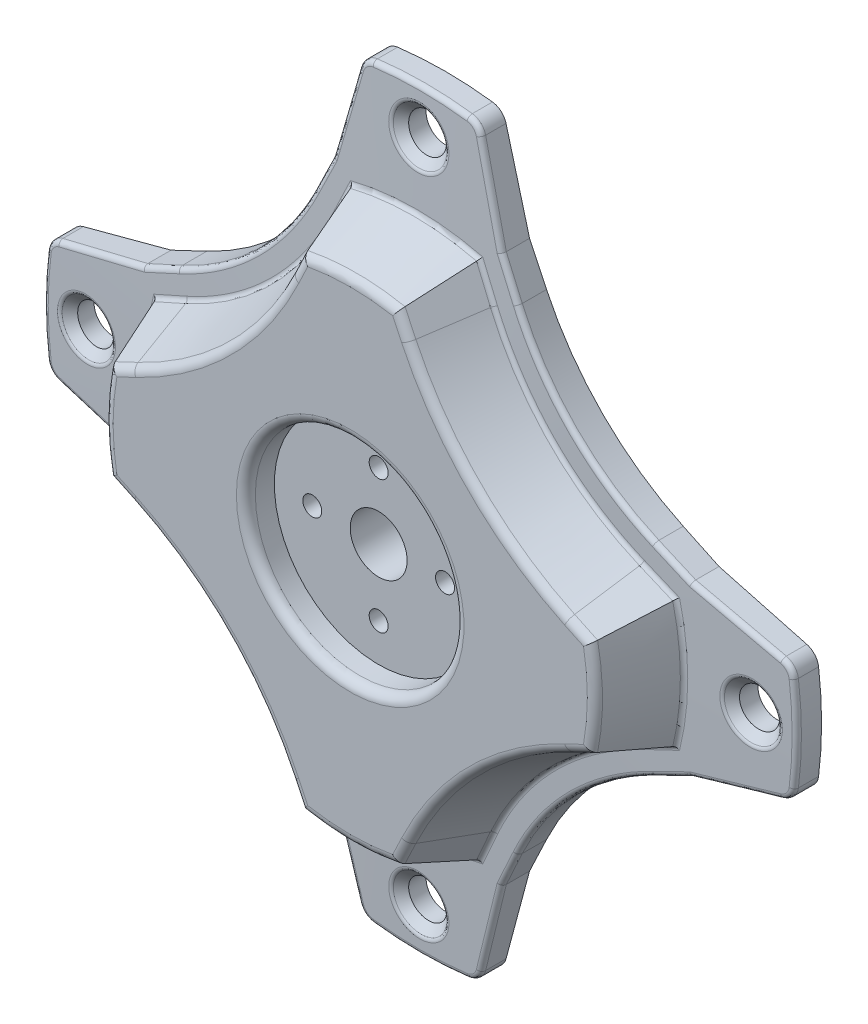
SolidWorks part; units mm, degrees
ref_plane "Front Plane" through (0, 0, 0) normal (0, 0, 1) x (1, 0, 0)
ref_plane "Top Plane" through (0, 0, 0) normal (0, 1, 0) x (1, 0, 0)
ref_plane "Right Plane" through (0, 0, 0) normal (1, 0, 0) x (0, 0, -1)
sketch "Sketch1" plane through (0, 0, 0) normal (0, 0, 1) x (1, 0, 0)
  line L24 (58.7956, 87.0406) -> (49.5461, 89.519)
  line L25 (49.5461, 89.519) -> (45.7694, 91.308)
  line L26 (29.5682, 109.4969) -> (27.0898, 118.7464)
  line L27 (14.2274, 118.7464) -> (11.749, 109.4969)
  line L28 (49.5461, 89.519) -> (45.7694, 91.308)
  line L29 (-8.2289, 89.519) -> (-17.4784, 87.0406)
  line L30 (-17.4784, 74.1781) -> (-8.2289, 71.6998)
  line L31 (31.3572, 105.7202) -> (29.5682, 109.4969)
  line L32 (11.749, 51.7219) -> (14.2274, 42.4724)
  line L33 (27.0898, 42.4724) -> (29.5682, 51.7219)
  line L34 (31.3572, 105.7202) -> (29.5682, 109.4969)
  line L35 (49.5461, 71.6998) -> (58.7956, 74.1781)
  line L36 (58.7956, 87.0406) -> (49.5461, 89.519)
  line L38 (29.5682, 109.4969) -> (27.0898, 118.7464)
  line L39 (14.2274, 118.7464) -> (11.749, 109.4969)
  line L41 (-8.2289, 89.519) -> (-17.4784, 87.0406)
  line L42 (-17.4784, 74.1781) -> (-8.2289, 71.6998)
  line L44 (11.749, 51.7219) -> (14.2274, 42.4724)
  line L45 (27.0898, 42.4724) -> (29.5682, 51.7219)
  line L47 (49.5461, 71.6998) -> (58.7956, 74.1781)
  line L76 (11.749, 109.4969) -> (9.96, 105.7202)
  line L77 (11.749, 109.4969) -> (9.96, 105.7202)
  line L78 (-4.4522, 91.308) -> (-8.2289, 89.519)
  line L79 (-4.4522, 91.308) -> (-8.2289, 89.519)
  line L80 (-8.2289, 71.6998) -> (-4.4522, 69.9108)
  line L81 (-8.2289, 71.6998) -> (-4.4522, 69.9108)
  line L82 (9.96, 55.4986) -> (11.749, 51.7219)
  line L83 (9.96, 55.4986) -> (11.749, 51.7219)
  line L84 (29.5682, 51.7219) -> (31.3572, 55.4986)
  line L85 (29.5682, 51.7219) -> (31.3572, 55.4986)
  line L86 (45.7694, 69.9108) -> (49.5461, 71.6998)
  line L87 (45.7694, 69.9108) -> (49.5461, 71.6998)
  arc A40 (60.042, 75.606) -> (60.042, 85.6128) centre (20.6586, 80.6094) ccw
  arc A41 (60.042, 85.6128) -> (58.7956, 87.0406) centre (58.3556, 85.3986) ccw
  arc A42 (31.3572, 105.7202) -> (45.7694, 91.308) centre (58.7404, 118.6912) ccw
  arc A43 (31.3572, 105.7202) -> (45.7694, 91.308) centre (58.7404, 118.6912) ccw
  arc A44 (27.0898, 118.7464) -> (25.662, 119.9928) centre (25.4478, 118.3064) ccw
  arc A45 (25.662, 119.9928) -> (15.6552, 119.9928) centre (20.6586, 80.6094) ccw
  arc A46 (15.6552, 119.9928) -> (14.2274, 118.7464) centre (15.8694, 118.3064) ccw
  arc A47 (-4.4522, 91.308) -> (9.96, 105.7202) centre (-17.4232, 118.6912) ccw
  arc A48 (-4.4522, 91.308) -> (9.96, 105.7202) centre (-17.4232, 118.6912) ccw
  arc A49 (-17.4784, 87.0406) -> (-18.7248, 85.6128) centre (-17.0384, 85.3986) ccw
  arc A50 (-18.7248, 85.6128) -> (-18.7248, 75.606) centre (20.6586, 80.6094) ccw
  arc A51 (-18.7248, 75.606) -> (-17.4784, 74.1781) centre (-17.0384, 75.8202) ccw
  arc A52 (9.96, 55.4986) -> (-4.4522, 69.9108) centre (-17.4232, 42.5275) ccw
  arc A53 (9.96, 55.4986) -> (-4.4522, 69.9108) centre (-17.4232, 42.5275) ccw
  arc A54 (14.2274, 42.4724) -> (15.6552, 41.2259) centre (15.8694, 42.9124) ccw
  arc A55 (15.6552, 41.2259) -> (25.662, 41.2259) centre (20.6586, 80.6094) ccw
  arc A56 (25.662, 41.2259) -> (27.0898, 42.4724) centre (25.4478, 42.9124) ccw
  arc A57 (45.7694, 69.9108) -> (31.3572, 55.4986) centre (58.7404, 42.5275) ccw
  arc A58 (45.7694, 69.9108) -> (31.3572, 55.4986) centre (58.7404, 42.5275) ccw
  arc A59 (58.7956, 74.1781) -> (60.042, 75.606) centre (58.3556, 75.8202) ccw
  arc A60 (60.042, 75.606) -> (60.042, 85.6128) centre (20.6586, 80.6094) ccw
  arc A61 (60.042, 85.6128) -> (58.7956, 87.0406) centre (58.3556, 85.3986) ccw
  arc A64 (27.0898, 118.7464) -> (25.662, 119.9928) centre (25.4478, 118.3064) ccw
  arc A65 (25.662, 119.9928) -> (15.6552, 119.9928) centre (20.6586, 80.6094) ccw
  arc A66 (15.6552, 119.9928) -> (14.2274, 118.7464) centre (15.8694, 118.3064) ccw
  arc A69 (-17.4784, 87.0406) -> (-18.7248, 85.6128) centre (-17.0384, 85.3986) ccw
  arc A70 (-18.7248, 85.6128) -> (-18.7248, 75.606) centre (20.6586, 80.6094) ccw
  arc A71 (-18.7248, 75.606) -> (-17.4784, 74.1781) centre (-17.0384, 75.8202) ccw
  arc A74 (14.2274, 42.4724) -> (15.6552, 41.2259) centre (15.8694, 42.9124) ccw
  arc A75 (15.6552, 41.2259) -> (25.662, 41.2259) centre (20.6586, 80.6094) ccw
  arc A76 (25.662, 41.2259) -> (27.0898, 42.4724) centre (25.4478, 42.9124) ccw
  arc A79 (58.7956, 74.1781) -> (60.042, 75.606) centre (58.3556, 75.8202) ccw
  dimension "D1" = 0.3
extrude "Boss-Extrude1" add sketch "Sketch1" along normal blind 4
sketch "Sketch2" plane through (20.6586, 80.6094, -44.1) normal (0, -1, 0) x (1, 0, 0)
  line L0 (0, 48.1) -> (0, 76.0511) construction
  line L1 (5.0034, 48.1) -> (-5.0034, 48.1) construction
  line L2 (59.9345, 46) -> (0, 48.093)
  line L4 (59.9345, 48.5424) -> (59.9345, 46)
  line L5 (0, 48.093) -> (0, 48.5424)
  line L6 (0, 48.5424) -> (59.9345, 48.5424)
  dimension "D1" = 2
revolve "Cut-Revolve1" cut sketch "Sketch2" angle 360 about L0
sketch "Sketch3" plane through (0, 0, 0) normal (0, 0, -1) x (-1, 0, 0)
  line L48 (-28.1545, 108.9775) -> (-30.0016, 105.0781)
  line L49 (-25.641, 118.3582) -> (-28.1545, 108.9775)
  line L50 (-13.1627, 108.9775) -> (-15.6762, 118.3582)
  line L51 (-11.3156, 105.0781) -> (-13.1627, 108.9775)
  line L52 (7.7095, 88.1053) -> (3.8101, 89.9524)
  line L53 (17.0902, 85.5918) -> (7.7095, 88.1053)
  line L54 (7.7095, 73.1135) -> (17.0902, 75.627)
  line L55 (3.8101, 71.2664) -> (7.7095, 73.1135)
  line L56 (-13.1627, 52.2413) -> (-11.3156, 56.1407)
  line L57 (-15.6762, 42.8606) -> (-13.1627, 52.2413)
  line L58 (-28.1545, 52.2413) -> (-25.641, 42.8606)
  line L59 (-30.0016, 56.1407) -> (-28.1545, 52.2413)
  line L60 (-49.0267, 73.1135) -> (-45.1273, 71.2664)
  line L61 (-58.4074, 75.627) -> (-49.0267, 73.1135)
  line L62 (-49.0267, 88.1053) -> (-58.4074, 85.5918)
  line L63 (-45.1273, 89.9524) -> (-49.0267, 88.1053)
  line L64 (-28.1545, 108.9775) -> (-30.0016, 105.0781)
  line L65 (-25.641, 118.3582) -> (-28.1545, 108.9775)
  line L66 (-13.1627, 108.9775) -> (-15.6762, 118.3582)
  line L67 (-11.3156, 105.0781) -> (-13.1627, 108.9775)
  line L68 (7.7095, 88.1053) -> (3.8101, 89.9524)
  line L69 (17.0902, 85.5918) -> (7.7095, 88.1053)
  line L70 (7.7095, 73.1135) -> (17.0902, 75.627)
  line L71 (3.8101, 71.2664) -> (7.7095, 73.1135)
  line L72 (-13.1627, 52.2413) -> (-11.3156, 56.1407)
  line L73 (-15.6762, 42.8606) -> (-13.1627, 52.2413)
  line L74 (-28.1545, 52.2413) -> (-25.641, 42.8606)
  line L75 (-30.0016, 56.1407) -> (-28.1545, 52.2413)
  line L76 (-49.0267, 73.1135) -> (-45.1273, 71.2664)
  line L77 (-58.4074, 75.627) -> (-49.0267, 73.1135)
  line L78 (-49.0267, 88.1053) -> (-58.4074, 85.5918)
  line L79 (-45.1273, 89.9524) -> (-49.0267, 88.1053)
  arc A32 (-28.1545, 52.2413) -> (-13.1627, 52.2413) centre (-20.6586, 80.6094) ccw
  arc A33 (7.7095, 73.1135) -> (7.7095, 88.1053) centre (-20.6586, 80.6094) ccw
  arc A34 (-13.1627, 108.9775) -> (-28.1545, 108.9775) centre (-20.6586, 80.6094) ccw
  arc A35 (-49.0267, 88.1053) -> (-49.0267, 73.1135) centre (-20.6586, 80.6094) ccw
  arc A48 (-45.1273, 89.9524) -> (-30.0016, 105.0781) centre (-58.7404, 118.6912) ccw
  arc A49 (-25.473, 118.5048) -> (-25.641, 118.3582) centre (-25.4478, 118.3064) ccw
  arc A50 (-15.8442, 118.5048) -> (-25.473, 118.5048) centre (-20.6586, 80.6094) ccw
  arc A51 (-15.6762, 118.3582) -> (-15.8442, 118.5048) centre (-15.8694, 118.3064) ccw
  arc A52 (-11.3156, 105.0781) -> (3.8101, 89.9524) centre (17.4232, 118.6912) ccw
  arc A53 (17.2368, 85.4238) -> (17.0902, 85.5918) centre (17.0384, 85.3986) ccw
  arc A54 (17.2368, 75.795) -> (17.2368, 85.4238) centre (-20.6586, 80.6094) ccw
  arc A55 (17.0902, 75.627) -> (17.2368, 75.795) centre (17.0384, 75.8202) ccw
  arc A56 (3.8101, 71.2664) -> (-11.3156, 56.1407) centre (17.4232, 42.5275) ccw
  arc A57 (-15.8442, 42.714) -> (-15.6762, 42.8606) centre (-15.8694, 42.9124) ccw
  arc A58 (-25.473, 42.714) -> (-15.8442, 42.714) centre (-20.6586, 80.6094) ccw
  arc A59 (-25.641, 42.8606) -> (-25.473, 42.714) centre (-25.4478, 42.9124) ccw
  arc A60 (-30.0016, 56.1407) -> (-45.1273, 71.2664) centre (-58.7404, 42.5275) ccw
  arc A61 (-58.554, 75.795) -> (-58.4074, 75.627) centre (-58.3556, 75.8202) ccw
  arc A62 (-58.554, 85.4238) -> (-58.554, 75.795) centre (-20.6586, 80.6094) ccw
  arc A63 (-58.4074, 85.5918) -> (-58.554, 85.4238) centre (-58.3556, 85.3986) ccw
  arc A64 (-45.1273, 89.9524) -> (-30.0016, 105.0781) centre (-58.7404, 118.6912) ccw
  arc A65 (-25.473, 118.5048) -> (-25.641, 118.3582) centre (-25.4478, 118.3064) ccw
  arc A66 (-15.8442, 118.5048) -> (-25.473, 118.5048) centre (-20.6586, 80.6094) ccw
  arc A67 (-15.6762, 118.3582) -> (-15.8442, 118.5048) centre (-15.8694, 118.3064) ccw
  arc A68 (-11.3156, 105.0781) -> (3.8101, 89.9524) centre (17.4232, 118.6912) ccw
  arc A69 (17.2368, 85.4238) -> (17.0902, 85.5918) centre (17.0384, 85.3986) ccw
  arc A70 (17.2368, 75.795) -> (17.2368, 85.4238) centre (-20.6586, 80.6094) ccw
  arc A71 (17.0902, 75.627) -> (17.2368, 75.795) centre (17.0384, 75.8202) ccw
  arc A72 (3.8101, 71.2664) -> (-11.3156, 56.1407) centre (17.4232, 42.5275) ccw
  arc A73 (-15.8442, 42.714) -> (-15.6762, 42.8606) centre (-15.8694, 42.9124) ccw
  arc A74 (-25.473, 42.714) -> (-15.8442, 42.714) centre (-20.6586, 80.6094) ccw
  arc A75 (-25.641, 42.8606) -> (-25.473, 42.714) centre (-25.4478, 42.9124) ccw
  arc A76 (-30.0016, 56.1407) -> (-45.1273, 71.2664) centre (-58.7404, 42.5275) ccw
  arc A77 (-58.554, 75.795) -> (-58.4074, 75.627) centre (-58.3556, 75.8202) ccw
  arc A78 (-58.554, 85.4238) -> (-58.554, 75.795) centre (-20.6586, 80.6094) ccw
  arc A79 (-58.4074, 85.5918) -> (-58.554, 85.4238) centre (-58.3556, 85.3986) ccw
  dimension "D1" = 1.5
extrude "Boss-Extrude2" add sketch "Sketch3" against normal blind 10 draft 20 contours A76 L75 A32 L72 A72 L71 A33 L68 A68 L67 A34 L64 A64 L79 A35 L76
sketch "Sketch5" plane through (0, 0, 10) normal (0, 0, 1) x (1, 0, 0)
  circle A0 centre (20.6586, 80.6094) radius 12.5
  dimension "D1" = 25
sketch "Sketch6" plane through (0, 0, 0) normal (0, 0, -1) x (-1, 0, 0)
  circle A0 centre (-20.6586, 45.6094) radius 2
  circle A1 centre (14.3414, 80.6094) radius 2
  circle A2 centre (-20.6586, 115.6094) radius 2
  circle A3 centre (-55.6586, 80.6094) radius 2.0146
extrude "Cut-Extrude1" cut sketch "Sketch6" against normal through all
chamfer "Chamfer1" distance 1 angle 45 4 edges at (21.7038, 47.3145, 2.8297) (-13.2846, 82.3074, 2.8062) (21.7187, 117.3054, 2.711) (56.7081, 82.3291, 2.7327)
sketch "Sketch7" plane through (0, 0, 10) normal (0, 0, 1) x (1, 0, 0)
  circle A0 centre (20.6586, 80.6094) radius 11
  dimension "D1" = 22
extrude "Cut-Extrude2" cut sketch "Sketch7" against normal blind 3
fillet "Fillet1" radius 1 17 edges at (26.1656, 56.5447, 10) (20.6586, 54.9074, 10) (15.1516, 56.5447, 10) (7.6364, 67.5872, 10) (-3.4061, 75.1024, 10) (-5.0434, 80.6094, 10) (-3.4061, 86.1163, 10) (7.6364, 93.6316, 10) (15.1516, 104.6741, 10) (20.6586, 106.3114, 10) (26.1656, 104.6741, 10) (33.6808, 93.6316, 10) (44.7233, 86.1163, 10) (46.3606, 80.6094, 10) (44.7233, 75.1024, 10) (33.6808, 67.5872, 10) (31.6586, 80.6094, 10)
fillet "Fillet2" radius 0.5 52 edges at (48.906, 80.6094, 3.0065) (34.7341, 96.0665, 3.2629) (20.6586, 108.8568, 3.0065) (5.2015, 94.6849, 3.2629) (6.5831, 65.1523, 3.2629) (20.6586, 52.362, 3.0065) (36.1157, 66.5339, 3.2629) (59.5392, 86.6188, 2.6191) (60.3586, 80.6094, 2.6066) (59.725, 74.8128, 2.6138) (37.1816, 63.8185, 3.1703) (26.668, 41.7288, 2.6191) (20.6586, 40.9094, 2.6066) (14.862, 41.543, 2.6138) (3.8677, 64.0864, 3.1703) (-18.222, 74.6, 2.6191) (-19.0414, 80.6094, 2.6066) (-18.4078, 86.4059, 2.6138) (4.1356, 97.4002, 3.1703) (14.6492, 119.49, 2.6191) (20.6586, 120.3094, 2.6066) (26.4551, 119.6758, 2.6138) (37.4494, 97.1324, 3.1703) (-7.5888, 80.6094, 3.0065)
sketch "Sketch8" plane through (0, 0, 7) normal (0, 0, 1) x (1, 0, 0)
  circle A0 centre (20.6586, 80.6094) radius 7 construction
  circle A1 centre (20.6586, 87.6094) radius 1
  circle A2 centre (13.6586, 80.6094) radius 1
  circle A3 centre (20.6586, 73.6094) radius 1
  circle A4 centre (27.6586, 80.6094) radius 1
  circle A5 centre (20.6586, 80.6094) radius 3
extrude "Cut-Extrude3" cut sketch "Sketch8" against normal through all
equation "\"HoleServoCyl\"= 2mm"
equation "\"D2@Sketch8\"=\"HoleServoCyl\""
equation "\"D3@Sketch8\"=\"HoleServoCyl\""
equation "\"D4@Sketch8\"=\"HoleServoCyl\""
equation "\"D5@Sketch8\"=\"HoleServoCyl\""
